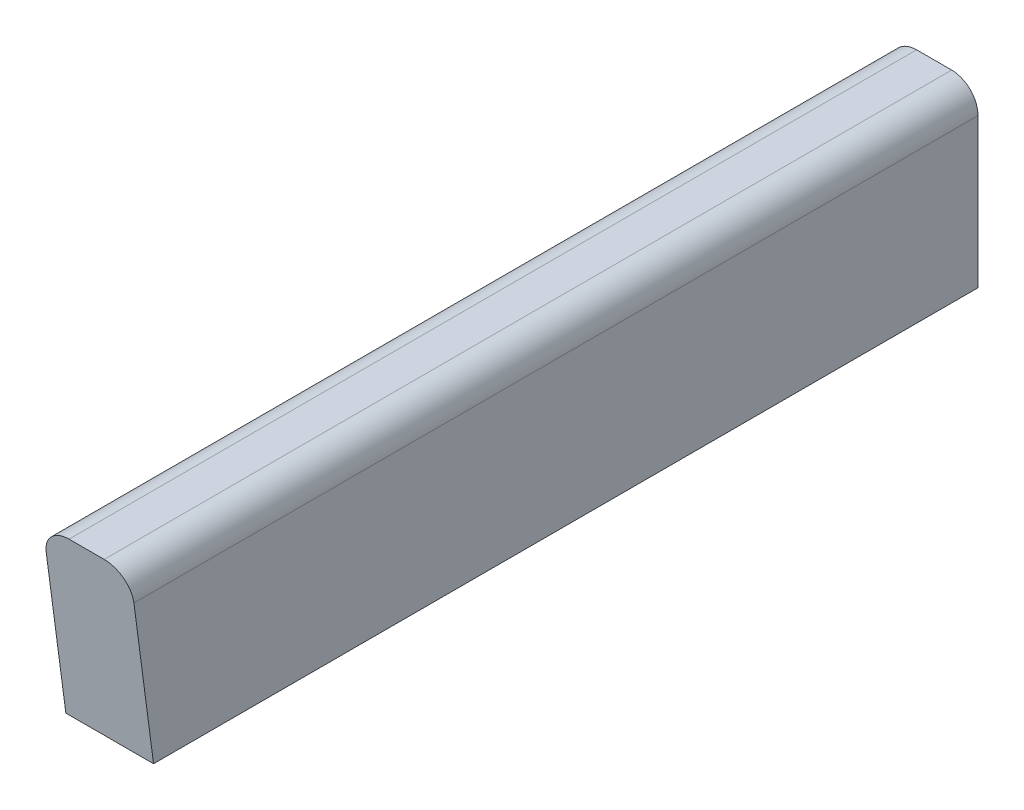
SolidWorks part; units mm, degrees
ref_plane "Ebene vorne" through (0, 0, 0) normal (0, 0, 1) x (1, 0, 0)
ref_plane "Ebene oben" through (0, 0, 0) normal (0, 1, 0) x (1, 0, 0)
ref_plane "Ebene rechts" through (0, 0, 0) normal (1, 0, 0) x (0, 0, -1)
sketch "Skizze1" plane through (0, 0, 0) normal (0, 0, 1) x (1, 0, 0)
  line L1 (0, 0) -> (10, 0)
  line L2 (0, 0) -> (0, 17)
  line L3 (3, 20) -> (7, 20)
  line L4 (10, 0) -> (10, 17)
  arc A0 (0, 17) -> (3, 20) centre (3, 17) cw
  arc A1 (10, 17) -> (7, 20) centre (7, 17) ccw
  point P7 (0, 20)
  dimension "D3" = 3
  dimension "D1" = 10
  dimension "D2" = 20
extrude "Linear austragen1" add sketch "Skizze1" along normal up to surface (94.0099 mm away)
